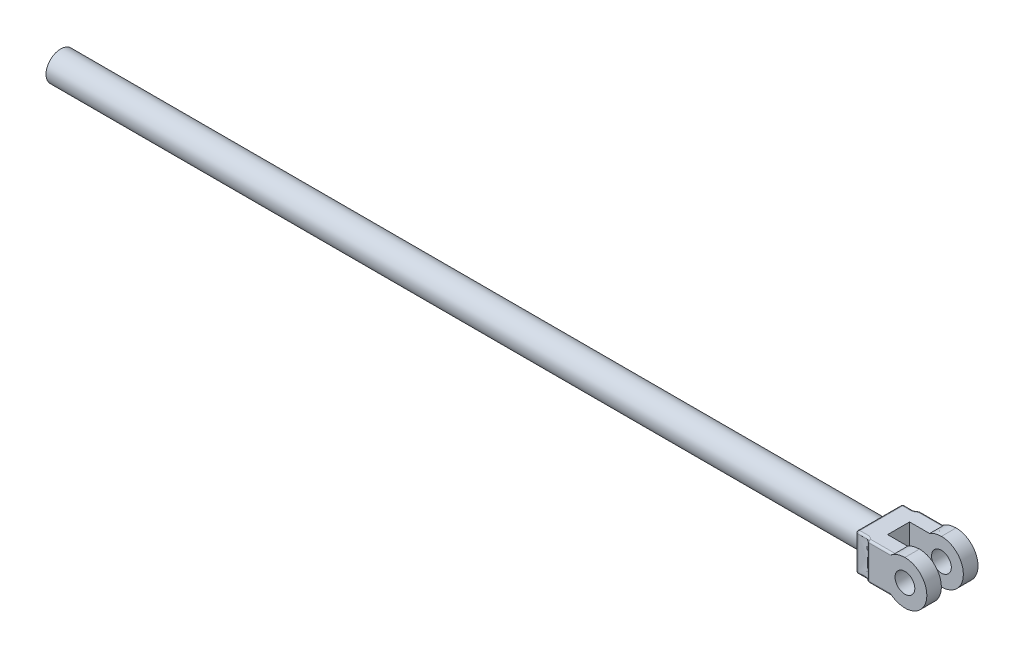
SolidWorks part; units mm, degrees
ref_plane "Front Plane" through (0, 0, 0) normal (0, 0, 1) x (1, 0, 0)
ref_plane "Top Plane" through (0, 0, 0) normal (0, 1, 0) x (1, 0, 0)
ref_plane "Right Plane" through (0, 0, 0) normal (1, 0, 0) x (0, 0, -1)
sketch "Sketch1" plane through (0, 0, 0) normal (0, 1, 0) x (1, 0, 0)
  line L0 (0, 0) -> (0, -18.9358)
  line L1 (0, -18.9358) -> (-95.3262, -18.9358)
  line L2 (-95.3262, -18.9358) -> (-95.3262, 47.744)
  line L3 (-95.3262, 47.744) -> (0, 47.744)
  line L4 (0, 47.744) -> (0, 28.6464)
  line L5 (0, 28.6464) -> (-70.0785, 28.6464)
  line L6 (-70.0785, 28.6464) -> (-70.0785, 0)
  line L7 (-70.0785, 0) -> (0, 0)
  dimension "D1" = 70.0785
  dimension "D2" = 95.3262
  dimension "D3" = 28.6464
  dimension "D4" = 47.744
  dimension "D5" = 18.9358
extrude "Extrude1" add sketch "Sketch1" along normal blind 57.15
sketch "Sketch2" plane through (0, 57.15, 0) normal (0, 1, 0) x (1, 0, 0)
  line L0 (0, 47.744) -> (-95.3262, 47.744) construction
  line L1 (-95.3262, 47.744) -> (-95.3262, -18.9358) construction
  line L2 (-99.8575, 44.7742) -> (-90.7948, 44.7742) construction
  line L4 (0, 28.6464) -> (0, 47.744) construction
  line L5 (-70.0785, 28.6464) -> (0, 28.6464) construction
  spline S0 degree 3 poles (-76.1925, 47.744) (-78.1871, 46.1977) (-80.1816, 44.6514) (-86.6359, 44.6514) (-89.2687, 44.7742) (-95.3262, 44.7742) knots 0 0 0 0 0.351544 0.351544 1 1 1 1
  dimension "D1" = 76.1925
  dimension "D2" = 82.4506
  dimension "D4" = 16.1278
extrude "Cut-Extrude1" cut sketch "Sketch2" against normal through all flip side to cut
ref_plane "Plane1" through (0, 0, -14.351) normal (0, 0, 1) x (1, 0, 0)
mirror "Mirror1" about plane through (0, 0, -14.351) normal (0, 0, 1) of "Cut-Extrude1"
sketch "Sketch3" plane through (0, 0, 18.9358) normal (0, 0, 1) x (1, 0, 0)
  line L0 (0, 57.15) -> (0, 0) construction
  line L1 (-76.3296, 57.15) -> (0, 57.15) construction
  circle A0 centre (-28.575, 28.575) radius 28.575
  dimension "D1" = 57.15
  dimension "D2" = 28.575
  dimension "D3" = 28.575
sketch "Sketch4" plane through (0, 0, 18.9358) normal (0, 0, 1) x (1, 0, 0)
  circle A0 centre (-28.575, 28.575) radius 12.8905
  dimension "D1" = 25.781
extrude "Cut-Extrude2" cut sketch "Sketch4" against normal through all
sketch "Sketch5" plane through (0, 0, 18.9358) normal (0, 0, 1) x (1, 0, 0)
  line L0 (-28.575, 0) -> (0, 0)
  line L1 (0, 28.575) -> (0, 0)
  line L2 (0, 57.15) -> (-28.575, 57.15)
  line L3 (-28.575, 57.15) -> (-28.7048, 57.2271)
  line L4 (0, 57.15) -> (0, 0) construction
  line L5 (-76.3296, 57.15) -> (0, 57.15) construction
  line L6 (0, 28.575) -> (0, 57.15)
  arc A0 (-28.575, 57.15) -> (-28.575, 0) centre (-28.575, 28.575) cw
  circle A1 centre (-28.575, 28.575) radius 28.575 construction
  dimension "D1" = 28.7048
  dimension "D2" = 0.0771
extrude "Cut-Extrude3" cut sketch "Sketch5" against normal through all
sketch "Sketch7" plane through (0, 0, 0) normal (0, 0, 1) x (1, 0, 0)
  line L0 (-95.3262, 52.687) -> (-43.9094, 52.687)
  line L1 (-95.3262, 57.15) -> (-95.3262, 0) construction
  line L2 (-95.3262, 52.687) -> (-95.3262, 57.15)
  line L3 (-95.3262, 57.15) -> (-28.575, 57.15)
  circle A0 centre (-28.575, 28.575) radius 28.575 construction
  spline S0 degree 3 poles (-43.9094, 52.687) (-41.7463, 54.0626) (-36.8362, 56.4375) (-31.4321, 56.9036) (-28.575, 57.15) knots 0 0 0 0 0.471295 1 1 1 1
  dimension "D1" = 37.0084
  dimension "D2" = 43.9094
  dimension "D3" = 55.8772
extrude "Cut-Extrude4" cut sketch "Sketch7" against normal through all and the other way through all
ref_plane "Plane2" through (0, 28.575, 0) normal (0, 1, 0) x (-1, 0, 0)
mirror "Mirror2" about plane through (0, 28.575, 0) normal (0, 1, 0) of "Cut-Extrude4"
sketch "Sketch9" plane through (-95.3262, 0, 0) normal (-1, 0, 0) x (0, 0, 1)
  line L0 (16.0722, 52.687) -> (16.0722, 4.463) construction
  line L1 (-44.7742, 4.463) -> (16.0722, 4.463) construction
  circle A0 centre (-14.351, 28.575) radius 19.05
  dimension "D1" = 38.1
  dimension "D2" = 30.4232
  dimension "D3" = 24.112
extrude "Extrude2" add sketch "Sketch9" along normal blind 1066.8
fillet "Fillet1" radius 2.54 14 edges at (-60.1195, 52.687, 18.9358) (-95.3262, 4.463, -14.351) (-60.051, 4.463, -47.744) (-95.3262, 28.575, 16.0722) (-76.1925, 28.575, -47.744) (-95.3262, 28.575, -44.7742) (-95.3262, 52.687, -14.351) (-60.051, 52.687, -47.744)
